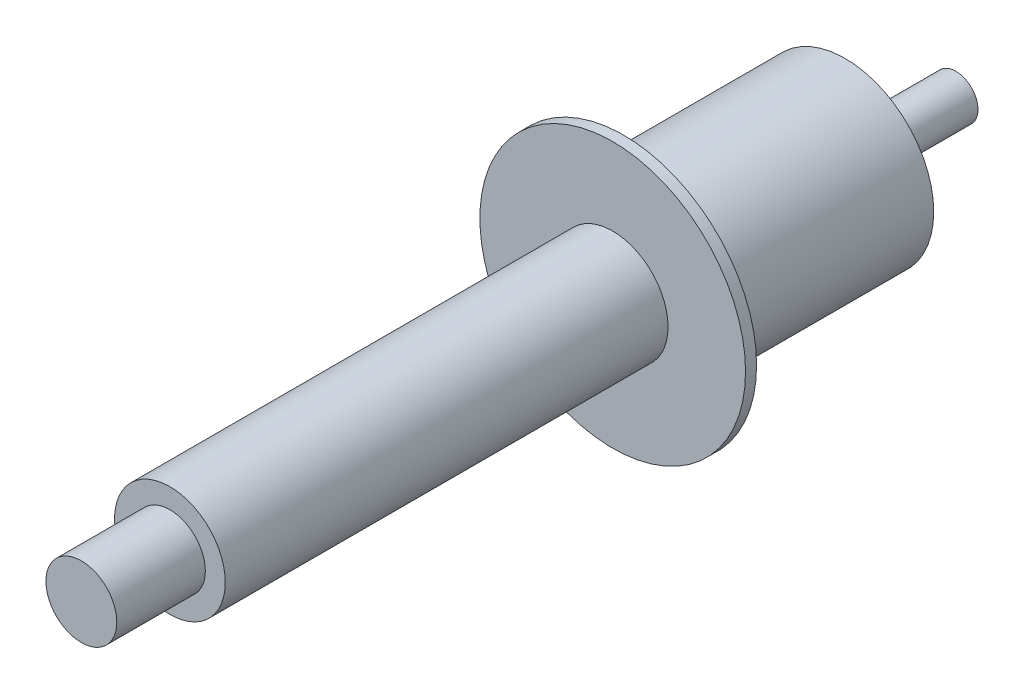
SolidWorks part; units mm, degrees
ref_plane "Ebene vorne" through (0, 0, 0) normal (0, 0, 1) x (1, 0, 0)
ref_plane "Ebene oben" through (0, 0, 0) normal (0, 1, 0) x (1, 0, 0)
ref_plane "Ebene rechts" through (0, 0, 0) normal (1, 0, 0) x (0, 0, -1)
sketch "Skizze1" plane through (0, 0, 0) normal (0, 0, 1) x (1, 0, 0)
  circle A0 centre (0, 0) radius 5
  dimension "D1" = 10
extrude "Linear austragen1" add sketch "Skizze1" along normal blind 20
sketch "Skizze2" plane through (0, 0, 20) normal (0, 0, 1) x (1, 0, 0)
  circle A0 centre (0, 0) radius 10
  dimension "D1" = 20
extrude "Linear austragen2" add sketch "Skizze2" along normal blind 5
sketch "Skizze3" plane through (0, 0, 25) normal (0, 0, 1) x (1, 0, 0)
  circle A0 centre (0, 0) radius 20
  dimension "D1" = 40
extrude "Linear austragen3" add sketch "Skizze3" along normal blind 50
sketch "Skizze4" plane through (0, 0, 75) normal (0, 0, 1) x (1, 0, 0)
  circle A0 centre (0, 0) radius 30
  dimension "D1" = 60
extrude "Linear austragen4" add sketch "Skizze4" along normal blind 2.5
sketch "Skizze5" plane through (0, 0, 77.5) normal (0, 0, 1) x (1, 0, 0)
  circle A0 centre (0, 0) radius 12.5
  dimension "D1" = 25
extrude "Linear austragen5" add sketch "Skizze5" along normal blind 100
sketch "Skizze6" plane through (0, 0, 177.5) normal (0, 0, 1) x (1, 0, 0)
  circle A0 centre (0, 0) radius 8
  dimension "D1" = 16
extrude "Linear austragen6" add sketch "Skizze6" along normal blind 20
